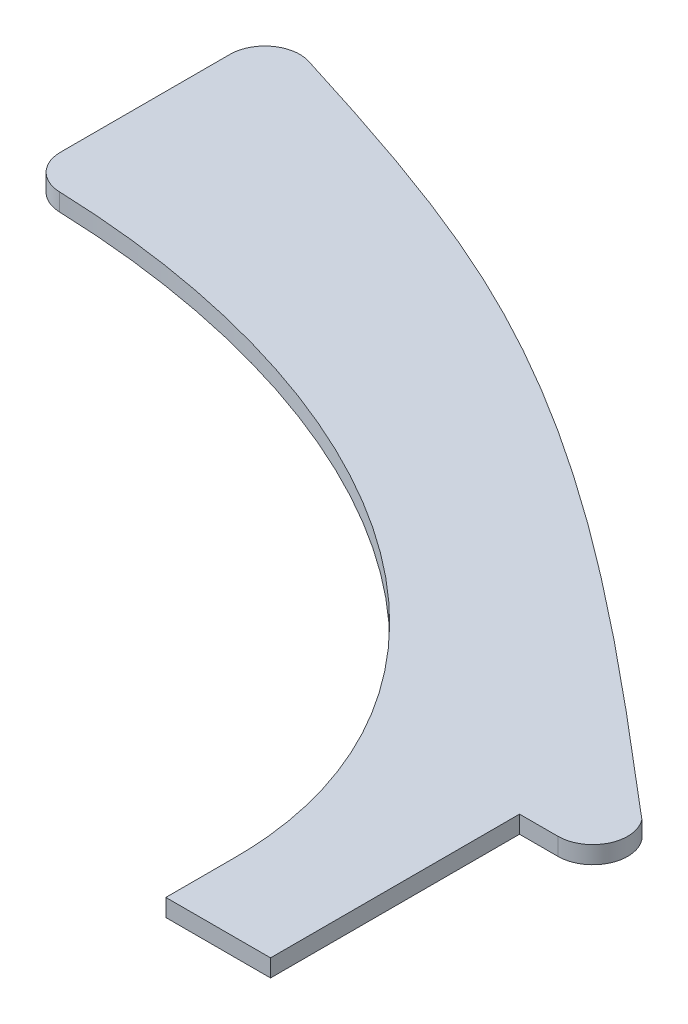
SolidWorks part; units mm, degrees
ref_plane "Front Plane" through (0, 0, 0) normal (0, 0, 1) x (1, 0, 0)
ref_plane "Top Plane" through (0, 0, 0) normal (0, 1, 0) x (1, 0, 0)
ref_plane "Right Plane" through (0, 0, 0) normal (1, 0, 0) x (0, 0, -1)
sketch "Sketch1" plane through (0, 0, 0) normal (0, 1, 0) x (1, 0, 0)
  line L0 (-50.7544, -0.0031) -> (-50.7544, -25.4031)
  line L1 (-304.7572, 202.3487) -> (-304.7572, 190.2837)
  line L2 (-50.7544, -25.4031) -> (-12.6572, -25.4031)
  line L3 (-12.6572, -25.4031) -> (-12.6572, 0)
  line L4 (-12.6572, 0) -> (-12.6572, 65.1924)
  line L5 (-12.6572, 65.1924) -> (1.3207, 65.1924)
  line L6 (-304.7572, 202.3487) -> (-304.7572, 251.9389)
  arc A0 (-288.2827, 264.065) -> (-304.7572, 251.9389) centre (-292.0572, 251.9389) ccw
  arc A1 (11.2864, 85.7647) -> (1.3207, 65.1924) centre (1.3207, 77.8924) cw
  arc A2 (-292.4883, 177.591) -> (-304.7572, 190.2837) centre (-292.0572, 190.2837) cw
  ellipse E1 centre (-304.8, 0) end of major axis (-50.7544, -0.0031) minor radius 177.8 (-292.4883, 177.591) -> (-50.7544, -0.0031) cw
  spline S0 degree 3 poles (11.2864, 85.7647) (-51.9961, 139.6325) (-142.5555, 216.7192) (-254.3779, 253.5114) (-288.2827, 264.065) knots 0 0 0 0 0.666317 0.953521 0.953521 0.953521 0.953521
  point P2 (0, 0)
  point P3 (0, 0)
  dimension "D5" = 12.7
  dimension "D1" = 12.7
  dimension "D4" = 25.4
  dimension "D6" = 65.1924
extrude "Extrude1" add sketch "Sketch1" along normal blind 6.35
